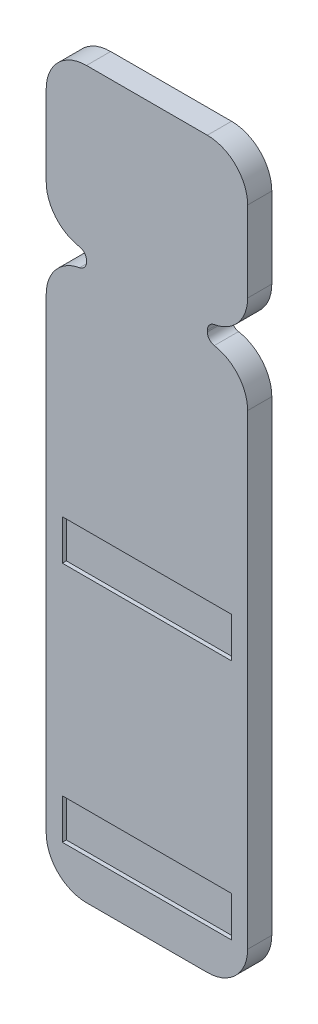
SolidWorks part; units mm, degrees
ref_plane "Plan de face" through (0, 0, 0) normal (0, 0, 1) x (1, 0, 0)
ref_plane "Plan de dessus" through (0, 0, 0) normal (0, 1, 0) x (1, 0, 0)
ref_plane "Plan de droite" through (0, 0, 0) normal (1, 0, 0) x (0, 0, -1)
sketch "Esquisse1" plane through (0, 0, 0) normal (0, 0, 1) x (1, 0, 0)
  line L0 (-50, 40) -> (-50, 20)
  line L1 (-50, 40) -> (-25, 40)
  line L2 (-50, 17.9) -> (-50, -50)
  line L3 (-50, -50) -> (-25, -50)
  line L4 (-25, 17.9) -> (-25, -50)
  line L5 (-50, 20) -> (-45, 20)
  line L6 (-25, 20) -> (-30, 20)
  line L7 (-50, 17.9) -> (-45, 17.9)
  line L8 (-45, 20) -> (-45, 17.9)
  line L9 (-30, 20) -> (-30, 17.9)
  line L10 (-30, 17.9) -> (-25, 17.9)
  line L11 (-25, 40) -> (-25, 20)
  dimension "D1" = 25
  dimension "D2" = 90
  dimension "D3" = 5
  dimension "D4" = 2.1
  dimension "D5" = 20
  dimension "D6" = 5
  dimension "D7" = 2.1
  dimension "D8" = 20
extrude "Extrusion1" add sketch "Esquisse1" along normal blind 3
fillet "Congé1" radius 5 12 edges at (-47.5, 20, 3) (-27.5, 20, 0) (-27.5, 17.9, 0) (-47.5, 17.9, 0) (-47.5, 20, 0) (-47.5, 17.9, 3) (-25, 20, 1.5) (-25, 17.9, 1.5) (-50, 17.9, 1.5) (-50, 20, 1.5) (-27.5, 17.9, 3) (-27.5, 20, 3)
fillet "Congé2" radius 1.05 4 edges at (-30, 20, 1.5) (-30, 17.9, 1.5) (-45, 17.9, 1.5) (-45, 20, 1.5)
fillet "Congé3" radius 5 4 edges at (-25, 40, 1.5) (-25, -50, 1.5) (-50, -50, 1.5) (-50, 40, 1.5)
sketch "Esquisse3" plane through (0, 0, 3) normal (0, 0, 1) x (1, 0, 0)
  line L0 (-25, -45) -> (-25, 12.9) construction
  line L1 (-48, -10) -> (-27, -10)
  line L2 (-48, -10) -> (-48, -15)
  line L3 (-48, -15) -> (-27, -15)
  line L4 (-27, -10) -> (-27, -15)
  line L5 (-50, 35) -> (-50, 25) construction
  line L6 (-30, 40) -> (-45, 40) construction
  line L7 (-25, -45) -> (-25, 12.9) construction
  line L8 (-48, -40) -> (-27, -40)
  line L9 (-48, -40) -> (-48, -45)
  line L10 (-48, -45) -> (-27, -45)
  line L11 (-27, -40) -> (-27, -45)
  line L12 (-50, 12.9) -> (-50, -45) construction
  line L13 (-45, -50) -> (-30, -50) construction
  dimension "D1" = 2
  dimension "D2" = 2
  dimension "D3" = 50
  dimension "D4" = 5
  dimension "D5" = 2
  dimension "D6" = 5
  dimension "D7" = 2
  dimension "D8" = 5
extrude "Enlèv. mat.-Extru.1" cut sketch "Esquisse3" against normal blind 0.5
